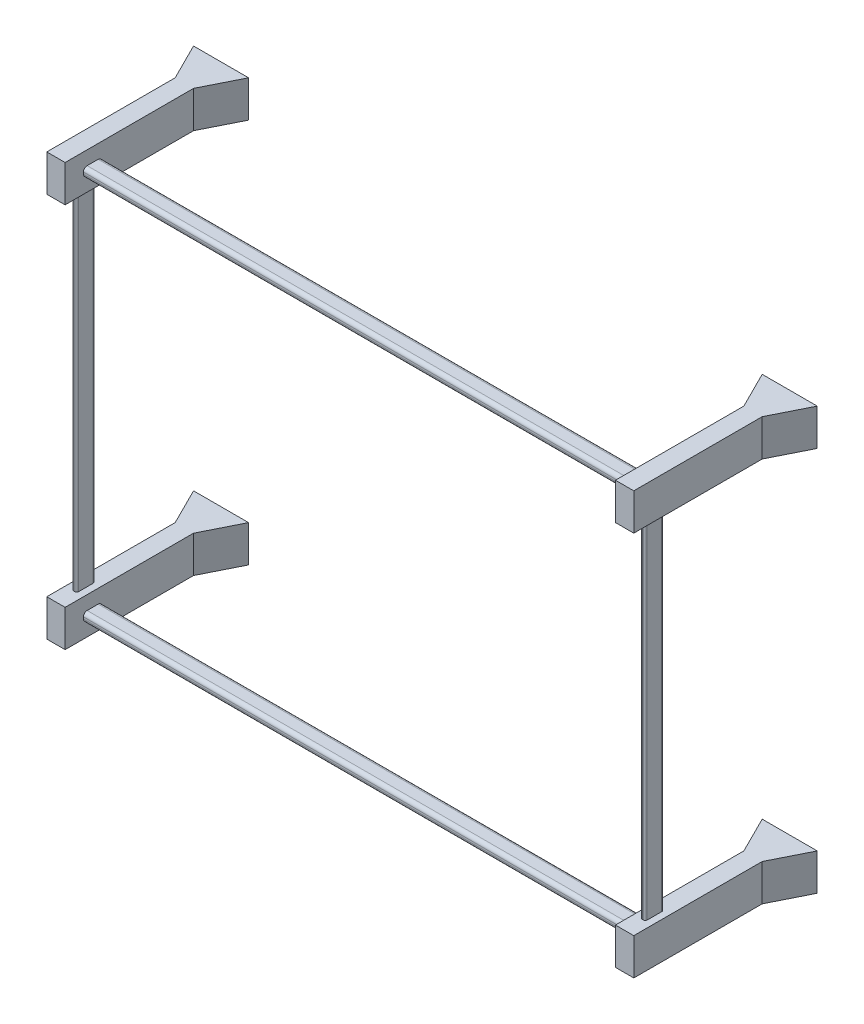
SolidWorks part; units mm, degrees
ref_plane "Front Plane" through (0, 0, 0) normal (0, 0, 1) x (1, 0, 0)
ref_plane "Top Plane" through (0, 0, 0) normal (0, 1, 0) x (1, 0, 0)
ref_plane "Right Plane" through (0, 0, 0) normal (1, 0, 0) x (0, 0, -1)
sketch "Sketch1" plane through (0, 0, 0) normal (0, 0, 1) x (1, 0, 0)
  line L1 (107.1429, -71.4286) -> (-107.1429, -71.4286)
  line L2 (107.1429, -71.4286) -> (107.1429, 71.4286)
  line L3 (107.1429, 71.4286) -> (-107.1429, 71.4286)
  line L4 (-107.1429, -71.4286) -> (-107.1429, 71.4286)
  line L5 (107.1429, -71.4286) -> (-107.1429, 71.4286) construction
  line L6 (107.1429, 71.4286) -> (-107.1429, -71.4286) construction
  point P0 (0, 0)
  dimension "D1" = 214.2857
  dimension "D2" = 142.8571
extrude "Boss-Extrude1" add sketch "Sketch1" along normal blind 642.8571
sketch "Sketch2" plane through (0, 0, 0) normal (0, 1, 0) x (1, 0, 0)
  line L0 (-107.1429, 0) -> (107.1429, 0)
  line L1 (107.1429, 0) -> (35.7143, -142.8571)
  line L2 (35.7143, -142.8571) -> (35.7143, -642.8571)
  line L3 (107.1429, -642.8571) -> (-107.1429, -642.8571) construction
  line L4 (35.7143, -642.8571) -> (-35.7143, -642.8571)
  line L5 (-35.7143, -642.8571) -> (-35.7143, -142.8571)
  line L6 (-35.7143, -142.8571) -> (-107.1429, 0)
  line L7 (0, 0) -> (0, -711.5608) construction
  dimension "D1" = 142.8571
  dimension "D2" = 142.8571
  dimension "D3" = 35.7143
  dimension "D4" = 35.7143
extrude "Cut-Extrude1" cut sketch "Sketch2" against normal through all both and the other way through all flip side to cut
ref_plane "Plane1" through (35.7143, 0, 0) normal (1, 0, 0) x (0, 0, -1)
sketch "Sketch3" plane through (35.7143, 0, 0) normal (1, 0, 0) x (0, 0, -1)
  line L0 (-662.8925, 0) -> (0, 0) construction
  line L1 (-642.8571, -71.4286) -> (-642.8571, 71.4286) construction
  line L2 (-514.2857, -17.8571) -> (-557.1429, -17.8571)
  line L3 (-500, -3.5714) -> (-500, 3.5714)
  line L4 (-514.2857, 17.8571) -> (-557.1429, 17.8571)
  line L5 (-571.4286, -3.5714) -> (-571.4286, 3.5714)
  line L6 (-500, -17.8571) -> (-571.4286, 17.8571) construction
  line L7 (-500, 17.8571) -> (-571.4286, -17.8571) construction
  arc A0 (-500, 3.5714) -> (-514.2857, 17.8571) centre (-514.2857, 3.5714) ccw
  arc A1 (-514.2857, -17.8571) -> (-500, -3.5714) centre (-514.2857, -3.5714) ccw
  arc A2 (-557.1429, -17.8571) -> (-571.4286, -3.5714) centre (-557.1429, -3.5714) cw
  arc A3 (-557.1429, 17.8571) -> (-571.4286, 3.5714) centre (-557.1429, 3.5714) ccw
  point P3 (-535.7143, 0)
  dimension "D4" = 14.2857
  dimension "D1" = 71.4286
  dimension "D2" = 35.7143
  dimension "D3" = 71.4286
extrude "Boss-Extrude2" add sketch "Sketch3" along normal blind 2142.8571
ref_plane "Plane2" through (2178.5714, 0, 0) normal (1, 0, 0) x (0, 0, -1)
sketch "Sketch4" plane through (2178.5714, 0, 0) normal (1, 0, 0) x (0, 0, -1)
  line L1 (0, 71.4286) -> (-642.8571, 71.4286)
  line L2 (0, 71.4286) -> (0, -71.4286)
  line L3 (0, -71.4286) -> (-642.8571, -71.4286)
  line L4 (-642.8571, 71.4286) -> (-642.8571, -71.4286)
extrude "Boss-Extrude3" add sketch "Sketch4" along normal blind 71.4286
sketch "Sketch5" plane through (0, 0, 0) normal (0, 1, 0) x (1, 0, 0)
  line L0 (2250, 0) -> (2250, -142.8571)
  line L1 (2250, 0) -> (2250, -642.8571) construction
  line L2 (2250, -142.8571) -> (2321.4286, 0)
  line L3 (2321.4286, 0) -> (2250, 0)
  line L4 (2178.5714, -142.8571) -> (2107.1429, 0)
  line L5 (2178.5714, -78.5714) -> (2178.5714, 78.5714) construction
  line L6 (2107.1429, 0) -> (2178.5714, 0)
  line L7 (2250, 0) -> (2178.5714, 0) construction
  line L8 (2178.5714, 0) -> (2178.5714, -142.8571)
  dimension "D1" = 71.4286
  dimension "D2" = 142.8571
  dimension "D3" = 142.8571
  dimension "D4" = 71.4286
extrude "Boss-Extrude4" add sketch "Sketch5" along normal up to surface and the other way up to surface
ref_plane "Plane3" through (0, 71.4286, 0) normal (0, 1, 0) x (1, 0, 0)
sketch "Sketch6" plane through (0, 71.4286, 0) normal (0, 1, 0) x (1, 0, 0)
  line L0 (2214.2857, 0) -> (2214.2857, -694.1438) construction
  line L1 (2321.4286, 0) -> (2107.1429, 0) construction
  line L2 (2250, -642.8571) -> (2178.5714, -642.8571) construction
  line L3 (2216.3648, -571.4286) -> (2212.2066, -571.4286)
  line L4 (2223.5076, -564.2857) -> (2223.5076, -507.1429)
  line L5 (2216.3648, -500) -> (2212.2066, -500)
  line L6 (2205.0638, -564.2857) -> (2205.0638, -507.1429)
  line L7 (2223.5076, -571.4286) -> (2205.0638, -500) construction
  line L8 (2223.5076, -500) -> (2205.0638, -571.4286) construction
  arc A0 (2216.3648, -571.4286) -> (2223.5076, -564.2857) centre (2216.3648, -564.2857) ccw
  arc A1 (2212.2066, -571.4286) -> (2205.0638, -564.2857) centre (2212.2066, -564.2857) cw
  arc A2 (2212.2066, -500) -> (2205.0638, -507.1429) centre (2212.2066, -507.1429) ccw
  arc A3 (2223.5076, -507.1429) -> (2216.3648, -500) centre (2216.3648, -507.1429) ccw
  point P4 (2214.2857, -535.7143)
  dimension "D3" = 7.1429
  dimension "D1" = 71.4286
  dimension "D2" = 71.4286
extrude "Boss-Extrude5" add sketch "Sketch6" along normal blind 1357.14
ref_plane "Plane4" through (0, 749.9986, 0) normal (0, 1, 0) x (1, 0, 0)
mirror "Mirror1" about plane through (0, 749.9986, 0) normal (0, 1, 0) of "Boss-Extrude3", "Boss-Extrude4"
mirror "Mirror3" about plane through (0, 749.9986, 0) normal (0, 1, 0) of "Boss-Extrude2"
ref_plane "Plane5" through (1107.1429, 0, 0) normal (1, 0, 0) x (0, 0, -1)
mirror "Mirror4" about plane through (1107.1429, 0, 0) normal (1, 0, 0) of "Boss-Extrude5", "Mirror1"
